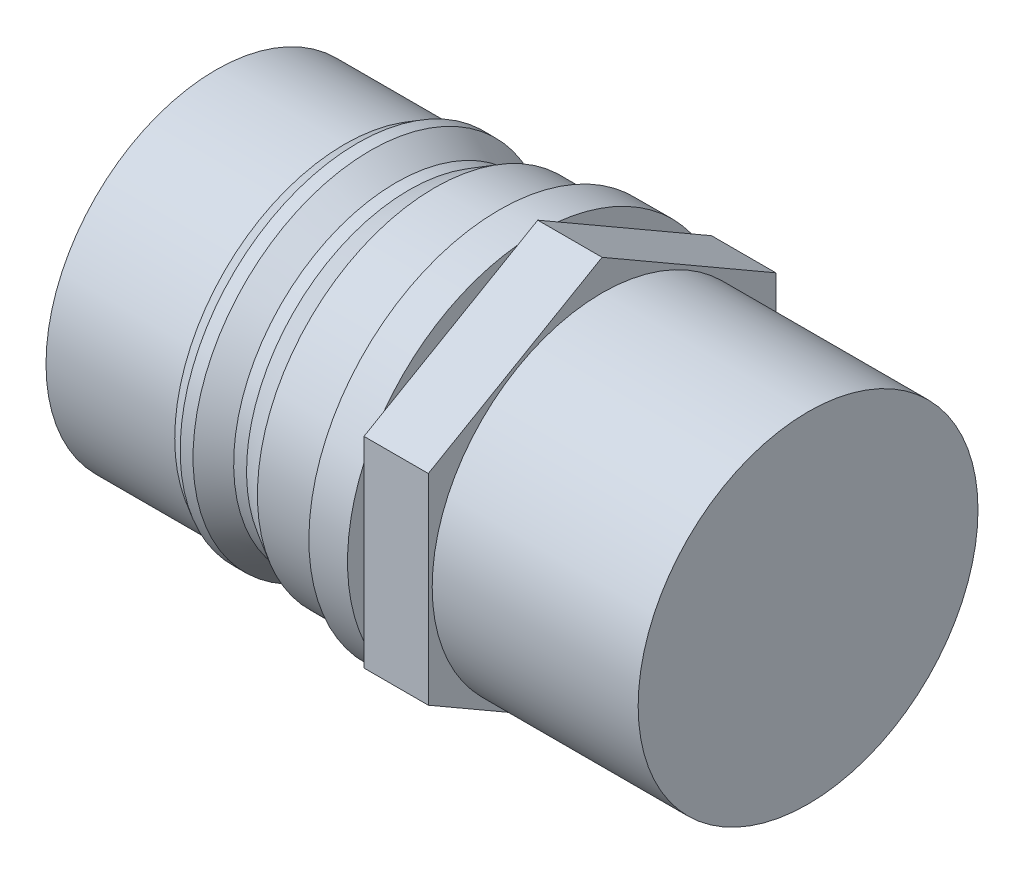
SolidWorks part; units mm, degrees
ref_plane "Alzado" through (0, 0, 0) normal (0, 0, 1) x (1, 0, 0)
ref_plane "Planta" through (0, 0, 0) normal (0, 1, 0) x (1, 0, 0)
ref_plane "Vista lateral" through (0, 0, 0) normal (1, 0, 0) x (0, 0, -1)
sketch "Croquis1" plane through (0, 0, 0) normal (0, 0, 1) x (1, 0, 0)
  line L0 (0, 0) -> (25, 0) construction
  line L1 (0, 0) -> (0, 13.2)
  line L2 (0, 13.2) -> (10, 13.2)
  line L3 (10, 13.2) -> (11, 13.7774)
  line L4 (11, 13.7774) -> (12, 13.7774)
  line L5 (11.5, 13.7774) -> (11.5, 0) construction
  line L6 (13, 13.2) -> (12, 13.7774)
  line L7 (13, 13.2) -> (14, 12.6226)
  line L8 (14, 12.6226) -> (15, 12.6226)
  line L9 (14.5, 12.6226) -> (14.5, 0) construction
  line L10 (16, 13.2) -> (15, 12.6226)
  line L11 (16, 13.2) -> (17, 13.7774)
  line L12 (17, 13.7774) -> (22, 13.7774)
  line L14 (25, 0) -> (0, 0)
  line L15 (22, 13.7774) -> (22, 14.7774)
  line L16 (22, 14.7774) -> (25, 14.7774)
  line L17 (25, 14.7774) -> (25, 0)
  point P18 (27.5743, 0)
  dimension "D1" = 26.4
  dimension "D2" = 10
  dimension "D3" = 1
  dimension "D4" = 1
  dimension "D5" = 150
  dimension "D6" = 1
  dimension "D7" = 1
  dimension "D8" = 5
  dimension "D9" = 1
  dimension "D10" = 3
revolve "Revolución1" add sketch "Croquis1" angle 360 about L14
sketch "Croquis8" plane through (25, 0, 0) normal (1, 0, 0) x (0, 0, -1)
  line L1 (0, 15.5885) -> (-13.5, 7.7942)
  line L2 (-13.5, 7.7942) -> (-13.5, -7.7942)
  line L3 (-13.5, -7.7942) -> (0, -15.5885)
  line L4 (0, -15.5885) -> (13.5, -7.7942)
  line L5 (13.5, -7.7942) -> (13.5, 7.7942)
  line L6 (13.5, 7.7942) -> (0, 15.5885)
  circle A0 centre (0, 0) radius 13.5 construction
  dimension "D1" = 27
extrude "Saliente-Extruir6" add sketch "Croquis8" along normal blind 5
sketch "Croquis11" plane through (0, 0, 0) normal (0, 0, 1) x (1, 0, 0)
  line L0 (30, 0) -> (52.1801, 0) construction
  line L1 (30, 7.7942) -> (30, -7.7942) construction
  line L2 (30, 0) -> (30, 13.2)
  line L3 (30, 13.2) -> (46, 13.2)
  line L4 (46, 13.2) -> (46, 0)
  line L5 (46, 0) -> (30, 0)
  dimension "D1" = 26.4
  dimension "D2" = 16
revolve "Revolución4" add sketch "Croquis11" angle 360 about L0
